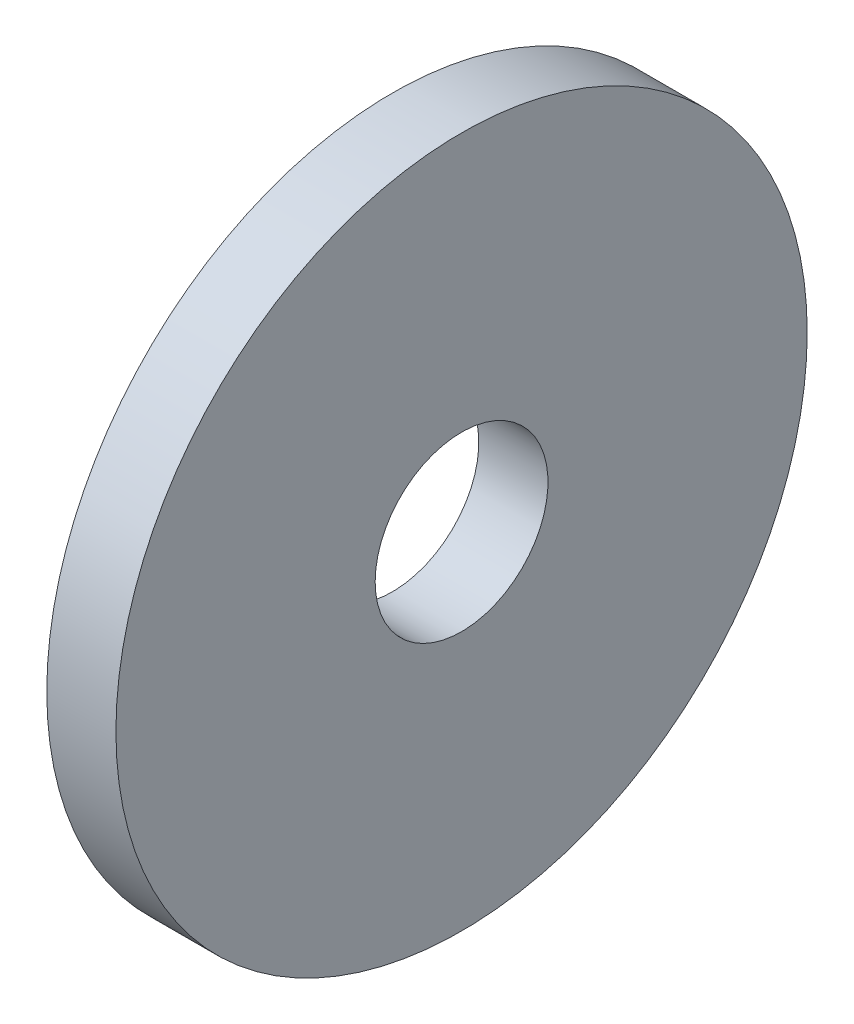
SolidWorks part; units mm, degrees
ref_plane "Front Plane" through (0, 0, 0) normal (0, 0, 1) x (1, 0, 0)
ref_plane "Top Plane" through (0, 0, 0) normal (0, 1, 0) x (1, 0, 0)
ref_plane "Right Plane" through (0, 0, 0) normal (1, 0, 0) x (0, 0, -1)
sketch "Sketch1" plane through (0, 0, 0) normal (1, 0, 0) x (0, 0, -1)
  circle A0 centre (0, 0) radius 6.7818
  circle A1 centre (0, 0) radius 1.6955
  dimension "D1" = 3.3909
  dimension "D2" = 13.5636
extrude "Extrude1" add sketch "Sketch1" along normal blind 1.3564
